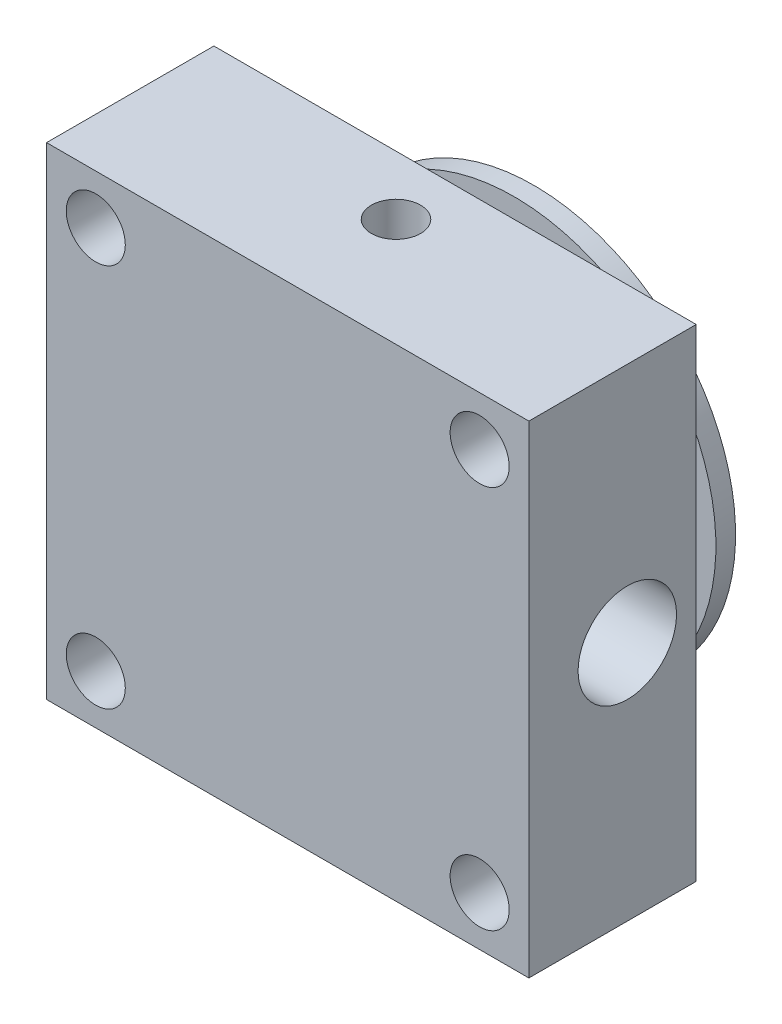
SolidWorks part; units mm, degrees
ref_plane "Plane1" through (0, 0, 0) normal (0, 0, 1) x (1, 0, 0)
ref_plane "Plane2" through (0, 0, 0) normal (0, 1, 0) x (1, 0, 0)
ref_plane "Plane3" through (0, 0, 0) normal (1, 0, 0) x (0, 0, -1)
sketch "Esquisse1" plane through (0, 0, 0) normal (0, 0, 1) x (1, 0, 0)
  line L0 (0, 0) -> (-49, 0)
  line L1 (0, 0) -> (0, 49)
  line L2 (-49, 49) -> (0, 49)
  line L3 (-49, 49) -> (-49, 0)
  dimension "D1" = 49
  dimension "D2" = 49
extrude "Base-Extrusion" add sketch "Esquisse1" along normal blind 17
sketch "Esquisse2" plane through (0, 0, 0) normal (0, 0, -1) x (-1, 0, 0)
  line L0 (49, 49) -> (49, 0) construction
  line L1 (0, 0) -> (49, 0) construction
  circle A0 centre (24.5, 24.5) radius 20.5
  dimension "D3" = 41
  dimension "D1" = 24.5
  dimension "D2" = 24.5
extrude "Boss.-Extru.1" add sketch "Esquisse2" along normal blind 8
sketch "Esquisse3" plane through (0, 0, 17) normal (0, 0, 1) x (1, 0, 0)
  line L0 (-49, 49) -> (0, 49) construction
  line L1 (0, 0) -> (-49, 0) construction
  line L2 (-49, 49) -> (-49, 0) construction
  line L3 (0, 0) -> (0, 49) construction
  circle A0 centre (-44, 44) radius 3
  circle A1 centre (-5, 44) radius 3
  circle A2 centre (-44, 5) radius 3
  circle A3 centre (-5, 5) radius 3
  dimension "D9" = 6
  dimension "D10" = 6
  dimension "D11" = 6
  dimension "D12" = 6
  dimension "D1" = 5
  dimension "D2" = 5
  dimension "D3" = 5
  dimension "D4" = 5
  dimension "D5" = 5
  dimension "D6" = 5
  dimension "D7" = 5
  dimension "D8" = 5
extrude "Enlèv. mat.-Extru.2" cut sketch "Esquisse3" against normal through all
ref_plane "Plan5" through (0, 0, -6) normal (0, 0, -1) x (-1, 0, 0)
sketch "Esquisse4" plane through (0, 0, -6) normal (0, 0, -1) x (-1, 0, 0)
  circle A0 centre (24.5, 24.5) radius 17.5
  circle A1 centre (24.5, 24.5) radius 22
  dimension "D1" = 35
  dimension "D2" = 44
extrude "Enlèv. mat.-Extru.3" cut sketch "Esquisse4" against normal blind 4
ref_plane "Plan7" through (0, 0, 7) normal (0, 0, 1) x (1, 0, 0)
sketch "Esquisse5" plane through (0, 0, 7) normal (0, 0, 1) x (1, 0, 0)
  line L0 (10, 29.5) -> (-10, 29.5)
  line L2 (-10, 29.5) -> (-12.8868, 24.5)
  line L3 (-12.8868, 24.5) -> (10, 24.5)
  line L4 (10, 29.5) -> (10, 24.5)
  line L5 (0, 0) -> (-49, 0) construction
  line L6 (0, 0) -> (0, 49) construction
  line L7 (-17.554, 24.5) -> (16.8025, 24.5) construction
  dimension "D1" = 24.5
  dimension "D2" = 5
  dimension "D3" = 10
  dimension "D4" = 60
revolve "Enlever de la matière-Pivoter1" cut sketch "Esquisse5" angle 360 about L7
sketch "Esquisse6" plane through (0, 0, 7) normal (0, 0, 1) x (1, 0, 0)
  line L0 (-60, 29.5) -> (-39, 29.5)
  line L1 (-39, 29.5) -> (-36.1132, 24.5)
  line L2 (-36.1132, 24.5) -> (-60, 24.5)
  line L3 (-60, 24.5) -> (-60, 29.5)
  line L4 (0, 0) -> (-49, 0) construction
  line L5 (-49, 49) -> (-49, 0) construction
  line L6 (-69.688, 24.5) -> (-31.4175, 24.5) construction
  dimension "D1" = 24.5
  dimension "D2" = 5
  dimension "D3" = 10
  dimension "D4" = 60
revolve "Enlever de la matière-Pivoter2" cut sketch "Esquisse6" angle 360 about L6
ref_plane "Plan8" through (0, 24.5, 0) normal (0, 1, 0) x (-1, 0, 0)
sketch "Esquisse7" plane through (0, 24.5, 0) normal (0, 1, 0) x (-1, 0, 0)
  line L0 (24.5, 20.1734) -> (24.5, -11.1734) construction
  line L1 (24.5, -58) -> (24.5, 42) construction
  line L2 (0, 17) -> (0, 0) construction
  line L3 (11.5, -10) -> (11.5, -2)
  line L4 (11.5, -2) -> (19.5, -2)
  line L5 (19.5, -2) -> (19.5, 10)
  line L6 (19.5, 10) -> (24.5, 12.8868)
  line L7 (24.5, 12.8868) -> (24.5, -10)
  line L8 (24.5, -10) -> (11.5, -10)
  line L9 (45, -8) -> (4, -8) construction
  dimension "D1" = 24.5
  dimension "D2" = 6
  dimension "D3" = 18
  dimension "D4" = 120
  dimension "D5" = 13
  dimension "D6" = 5
revolve "Enlever de la matière-Pivoter3" cut sketch "Esquisse7" angle 360 about L0
sketch "Esquisse8" plane through (0, 49, 0) normal (0, 1, 0) x (-1, 0, 0)
  line L0 (45, -8) -> (4, -8) construction
  line L1 (0, 17) -> (0, 0) construction
  circle A0 centre (24.5, 6) radius 2.5
  dimension "D1" = 5
  dimension "D2" = 14
  dimension "D3" = 24.5
extrude "Enlèv. mat.-Extru.4" cut sketch "Esquisse8" against normal up to next
